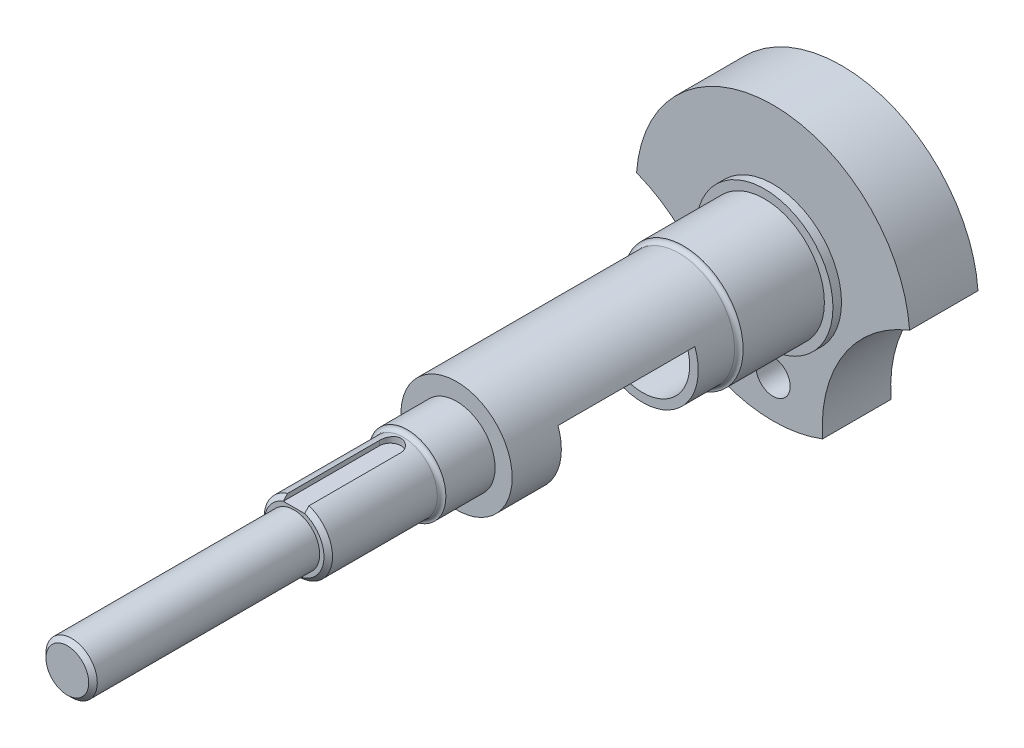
SolidWorks part; units mm, degrees
ref_plane "Plan1" through (0, 0, 0) normal (0, 0, 1) x (1, 0, 0)
ref_plane "Plan2" through (0, 0, 0) normal (0, 1, 0) x (1, 0, 0)
ref_plane "Plan3" through (0, 0, 0) normal (1, 0, 0) x (0, 0, -1)
sketch "Esquisse1" plane through (0, 0, 0) normal (0, 0, 1) x (1, 0, 0)
  line L0 (0, 40) -> (0, -50) construction
  arc A0 (15.9576, 1.1647) -> (-15.9576, 1.1647) centre (0, 0) ccw
  arc A1 (5.7924, -14.9147) -> (15.9576, 1.1647) centre (21.75, -13.75) cw
  arc A3 (-5.7924, -14.9147) -> (-15.9576, 1.1647) centre (-21.75, -13.75) ccw
  arc A4 (-5.7924, -14.9147) -> (5.7924, -14.9147) centre (0, 0) ccw
  dimension "D1" = 16
  dimension "D3" = 16
  dimension "D4" = 16
  dimension "D5" = 21.75
  dimension "D6" = 13.75
extrude "Base-Extrusion" add sketch "Esquisse1" along normal blind 8
sketch "Esquisse2" plane through (0, 0, 8) normal (0, 0, 1) x (1, 0, 0)
  circle A0 centre (0, 0) radius 8
  dimension "D1" = 16
extrude "Boss.-Extru.1" add sketch "Esquisse2" along normal blind 1
sketch "Esquisse3" plane through (0, 0, 9) normal (0, 0, 1) x (1, 0, 0)
  circle A0 centre (0, 0) radius 7
  dimension "D1" = 14
extrude "Boss.-Extru.2" add sketch "Esquisse3" along normal blind 9.5
sketch "Esquisse4" plane through (0, 0, 18.5) normal (0, 0, 1) x (1, 0, 0)
  circle A0 centre (0, 0) radius 6.5
  dimension "D1" = 13
extrude "Boss.-Extru.3" add sketch "Esquisse4" along normal blind 26.5
sketch "Esquisse5" plane through (0, 0, 45) normal (0, 0, 1) x (1, 0, 0)
  circle A0 centre (0, 0) radius 4.5
  dimension "D1" = 9
extrude "Boss.-Extru.4" add sketch "Esquisse5" along normal blind 5.75
sketch "Esquisse6" plane through (0, 0, 50.75) normal (0, 0, 1) x (1, 0, 0)
  circle A0 centre (0, 0) radius 4
  dimension "D1" = 8
extrude "Boss.-Extru.5" add sketch "Esquisse6" along normal blind 13.25
sketch "Esquisse7" plane through (0, 0, 64) normal (0, 0, 1) x (1, 0, 0)
  circle A0 centre (0, 0) radius 3
  dimension "D1" = 6
extrude "Boss.-Extru.6" add sketch "Esquisse7" along normal blind 26.5
sketch "Esquisse8" plane through (0, 0, 8) normal (0, 0, 1) x (1, 0, 0)
  circle A0 centre (0, -11.5) radius 2
  dimension "D1" = 4
  dimension "D2" = 11.5
extrude "Enlèv. mat.-Extru.1" cut sketch "Esquisse8" against normal through all
fillet "Congé1" radius 0.5 1 edges at (6.5, 0, 18.5)
fillet "Congé2" radius 0.5 1 edges at (4, 0, 50.75)
chamfer "Chanfrein1" distance 0.5 angle 45 1 edges at (4, 0, 64)
chamfer "Chanfrein2" distance 0.5 angle 45 1 edges at (3, 0, 90.5)
hole_wizard "Perçage2" positions "Esquisse12" profile "Esquisse11" hole size "M20" standard "ISO"
sketch "Esquisse12" plane through (0, 0, 0) normal (0, 0, -1) x (-1, 0, 0)
  point P0 (0, 0)
sketch "Esquisse11" plane through (0, 0, 0) normal (1, 0, 0) x (0, 1, 0)
  line L0 (0, 0) -> (0, 43.3047)
  line L1 (0, 43.3047) -> (5.5, 40)
  line L2 (5.5, 40) -> (5.5, 0)
  line L5 (5.5, 0) -> (0, 0)
  line L10 (0, 43.3047) -> (-5.5, 40) construction
  line L11 (0, -6.35) -> (0, 107.95) construction
  dimension "Diamètre du perçage" = 11
  dimension "Profondeur du perçage" = 40
  dimension "Angle de pointe" = 118
ref_plane "Plan4" through (0, 0, 0) normal (-0.7071, 0.7071, 0) x (0, 0, -1)
ref_plane "Plan5" through (1.9445, -1.9445, 0) normal (-0.7071, 0.7071, 0) x (0, 0, 1)
sketch "Esquisse13" plane through (1.9445, -1.9445, 0) normal (-0.7071, 0.7071, 0) x (0, 0, 1)
  line L0 (45, -6.5) -> (45, 6.5) construction
  line L1 (23.25, 28.7) -> (39.25, 28.7)
  line L2 (23.25, 28.7) -> (23.25, -23.9)
  line L3 (23.25, -23.9) -> (39.25, -23.9)
  line L4 (39.25, 28.7) -> (39.25, -23.9)
  dimension "D1" = 5.75
  dimension "D2" = 16
extrude "Enlèv. mat.-Extru.2" cut sketch "Esquisse13" against normal through all
ref_plane "Plan6" through (0, 3.25, 0) normal (0, 1, 0) x (-1, 0, 0)
sketch "Esquisse14" plane through (0, 3.25, 0) normal (0, 1, 0) x (-1, 0, 0)
  line L0 (-1.25, 64) -> (-1.25, 52.75)
  line L1 (1.25, 64) -> (1.25, 52.75)
  line L2 (3.5, 64) -> (-3.5, 64) construction
  line L3 (1.25, 64) -> (-1.25, 64)
  line L4 (0, 8) -> (0, 0) construction
  arc A0 (-1.25, 52.75) -> (1.25, 52.75) centre (0, 52.75) ccw
  dimension "D1" = 2.5
  dimension "D2" = 1.25
  dimension "D4" = 11.25
extrude "Enlèv. mat.-Extru.3" cut sketch "Esquisse14" along normal through all
